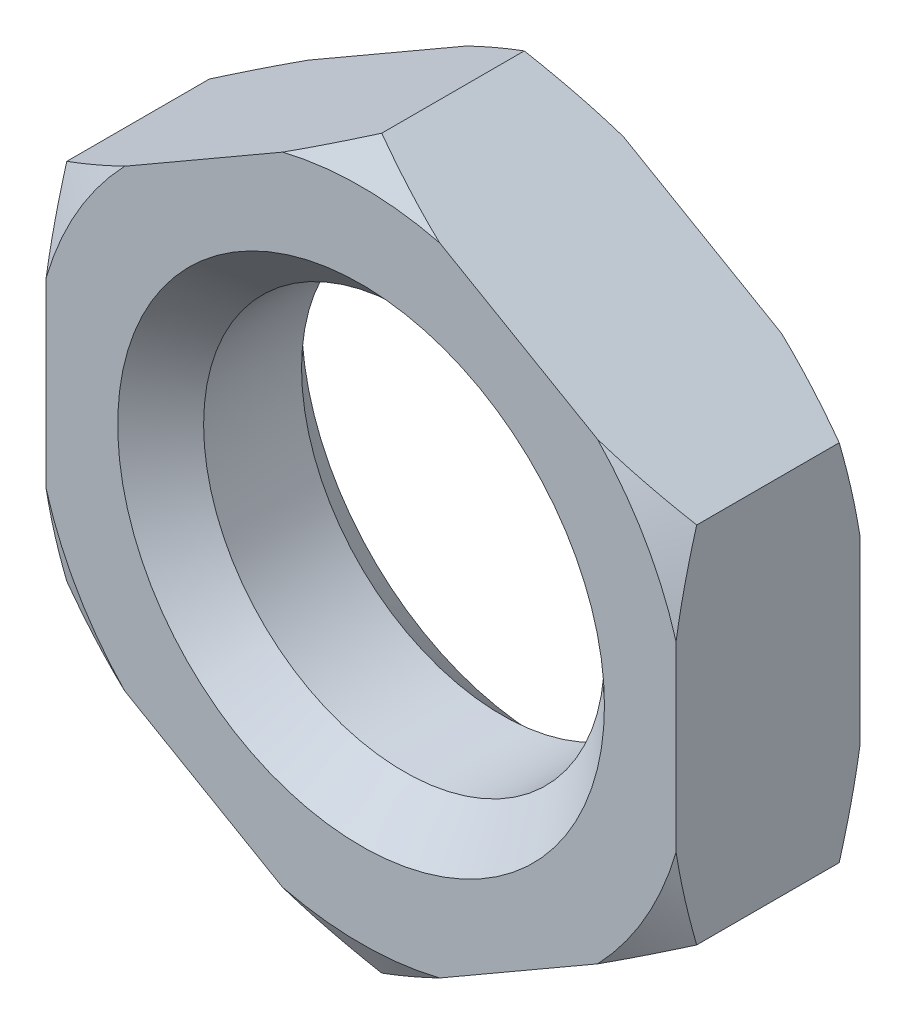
SolidWorks part; units mm, degrees
ref_plane "Front Plane" through (0, 0, 0) normal (0, 0, 1) x (1, 0, 0)
ref_plane "Top Plane" through (0, 0, 0) normal (0, 1, 0) x (1, 0, 0)
ref_plane "Right Plane" through (0, 0, 0) normal (1, 0, 0) x (0, 0, -1)
sketch "Sketch1" plane through (0, 0, 0) normal (0, 0, 1) x (1, 0, 0)
  line L1 (0, 12.7017) -> (-11, 6.3509)
  line L2 (-11, 6.3509) -> (-11, -6.3509)
  line L3 (-11, -6.3509) -> (0, -12.7017)
  line L4 (0, -12.7017) -> (11, -6.3509)
  line L5 (11, -6.3509) -> (11, 6.3509)
  line L6 (11, 6.3509) -> (0, 12.7017)
  circle A0 centre (0, 0) radius 11 construction
  circle A1 centre (0, 0) radius 7
  dimension "D2" = 14
  dimension "D1" = 22
extrude "Boss-Extrude1" add sketch "Sketch1" along normal mid plane 6.42
sketch "Sketch2" plane through (0, 0, 0) normal (1, 0, 0) x (0, 0, -1)
  line L0 (7.477, 0) -> (-8.5759, 0) construction
sketch "Sketch3" plane through (0, 0, 0) normal (1, 0, 0) x (0, 0, -1)
  line L0 (-3.21, 12.7017) -> (-3.21, 11.4517)
  line L1 (-3.21, 6.3509) -> (-3.21, 12.7017) construction
  line L2 (-3.21, 11.4517) -> (-2.4883, 12.7017)
  line L3 (-3.21, 12.7017) -> (3.21, 12.7017) construction
  line L4 (-2.4883, 12.7017) -> (-3.21, 12.7017)
  dimension "D1" = 1.25
  dimension "D2" = 30
revolve "Cut-Revolve1" cut sketch "Sketch3" angle 360 about L0
mirror "Mirror1" about plane through (0, 0, 0) normal (0, 0, 1) of "Cut-Revolve1"
chamfer "Chamfer1" distance 1.5 angle 45 2 edges at (7, 0, -3.21) (7, 0, 3.21)
